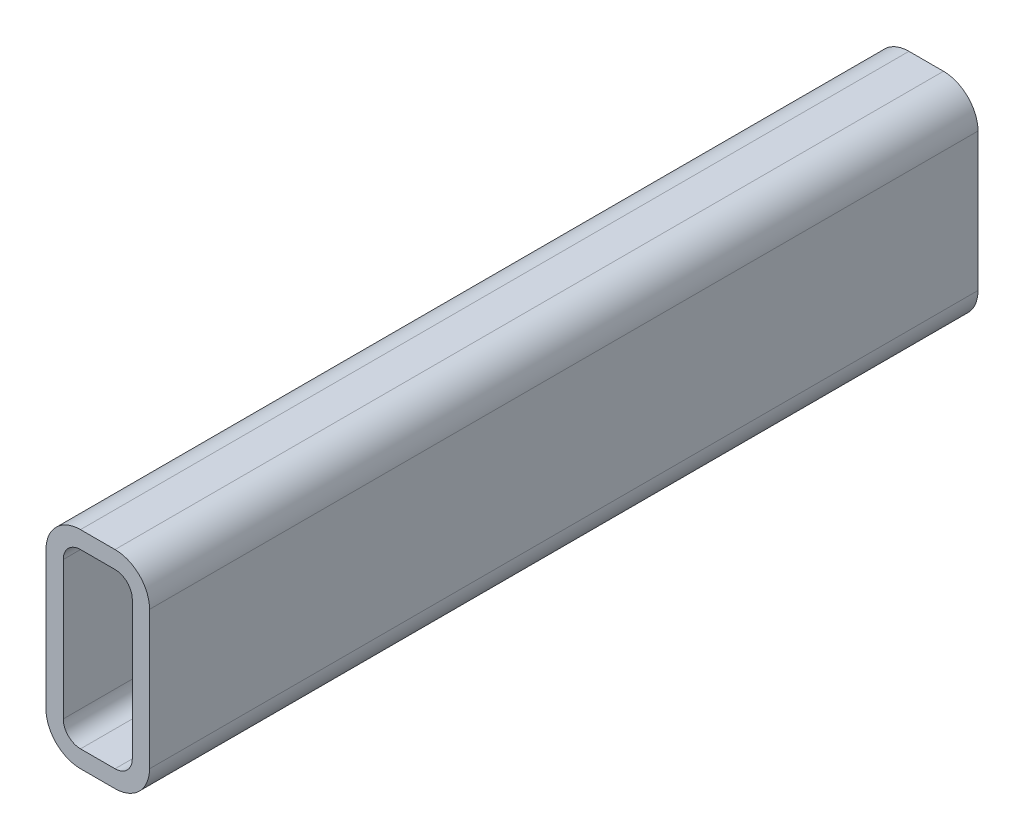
SolidWorks part; units mm, degrees
ref_plane "Front Plane" through (0, 0, 0) normal (0, 0, 1) x (1, 0, 0)
ref_plane "Top Plane" through (0, 0, 0) normal (0, 1, 0) x (1, 0, 0)
ref_plane "Right Plane" through (0, 0, 0) normal (1, 0, 0) x (0, 0, -1)
sketch "Sketch1" plane through (0, 0, 0) normal (0, 0, 1) x (1, 0, 0)
  line B0 (12.7, 76.2) -> (25.4, 76.2)
  arc B1 (38.1, 63.5) -> (25.4, 76.2) centre (25.4, 63.5) ccw
  line B2 (38.1, 63.5) -> (38.1, 12.7)
  arc B3 (25.4, 0) -> (38.1, 12.7) centre (25.4, 12.7) ccw
  line B4 (25.4, 0) -> (12.7, 0)
  arc B5 (0, 12.7) -> (12.7, 0) centre (12.7, 12.7) ccw
  line B6 (0, 12.7) -> (0, 63.5)
  arc B7 (12.7, 76.2) -> (0, 63.5) centre (12.7, 63.5) ccw
  line B8 (12.7, 69.85) -> (25.4, 69.85)
  arc B9 (31.75, 63.5) -> (25.4, 69.85) centre (25.4, 63.5) ccw
  line B10 (31.75, 63.5) -> (31.75, 12.7)
  arc B11 (25.4, 6.35) -> (31.75, 12.7) centre (25.4, 12.7) ccw
  line B12 (25.4, 6.35) -> (12.7, 6.35)
  arc B13 (6.35, 12.7) -> (12.7, 6.35) centre (12.7, 12.7) ccw
  line B14 (6.35, 12.7) -> (6.35, 63.5)
  arc B15 (12.7, 69.85) -> (6.35, 63.5) centre (12.7, 63.5) ccw
sketch_block_instance "HSS3x1.5x0.250-1"
sketch_block "HSS3x1.5x0.250"
extrude "Boss-Extrude1" add sketch "Sketch1" along normal blind 304.8
